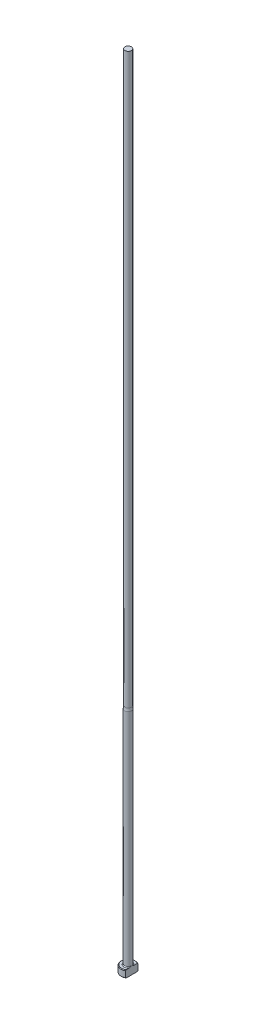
SolidWorks part; units mm, degrees
ref_plane "Front Plane" through (0, 0, 0) normal (0, 0, 1) x (1, 0, 0)
ref_plane "Top Plane" through (0, 0, 0) normal (0, 1, 0) x (1, 0, 0)
ref_plane "Right Plane" through (0, 0, 0) normal (1, 0, 0) x (0, 0, -1)
sketch "Sketch1" plane through (0, 0, 0) normal (0, 0, 1) x (1, 0, 0)
  line L0 (0, 259.9588) -> (0, -15.1925) construction
  line L1 (0, 0) -> (-3.175, 0)
  line L2 (-3.175, 0) -> (-3.175, 3.175)
  line L3 (-3.175, 3.175) -> (-1.5875, 3.175)
  line L4 (-1.4516, 102.9067) -> (-1.4516, 355.6)
  line L5 (-1.4516, 355.6) -> (0, 355.6)
  line L6 (0, 355.6) -> (0, 0)
  line L7 (-1.5875, 3.175) -> (-1.5875, 101.6)
  arc A0 (-1.5875, 101.6) -> (-1.4516, 102.9067) centre (-7.8016, 102.9067) ccw
  point P13 (-1.5875, 0)
  dimension "D1" = 6.35
  dimension "L" = 355.6
  dimension "D2" = 3.175
  dimension "H" = 6.35
  dimension "T" = 3.175
  dimension "D" = 2.9032
  dimension "S" = 101.6
revolve "Revolve1" add sketch "Sketch1" angle 360 about L0
chamfer "Chamfer1" distance 0.254 angle 45 2 edges at (0, 3.175, 3.175) (0, 0, 3.175)
fillet "Fillet1" radius 0.381 1 edges at (0, 3.175, 1.5875)
sketch "Sketch2" plane through (0, 0, 0) normal (0, 1, 0) x (1, 0, 0)
  line L0 (1.5875, -2.7496) -> (1.5875, 2.7496)
  circle A0 centre (0, 0) radius 3.175 construction
  arc A2 (1.5875, -2.7496) -> (1.5875, 2.7496) centre (0, 0) ccw
  circle A3 centre (0, 0) radius 3.175 construction
  circle A4 centre (0, 0) radius 1.5875 construction
extrude "Key Head" cut sketch "Sketch2" along normal up to next
